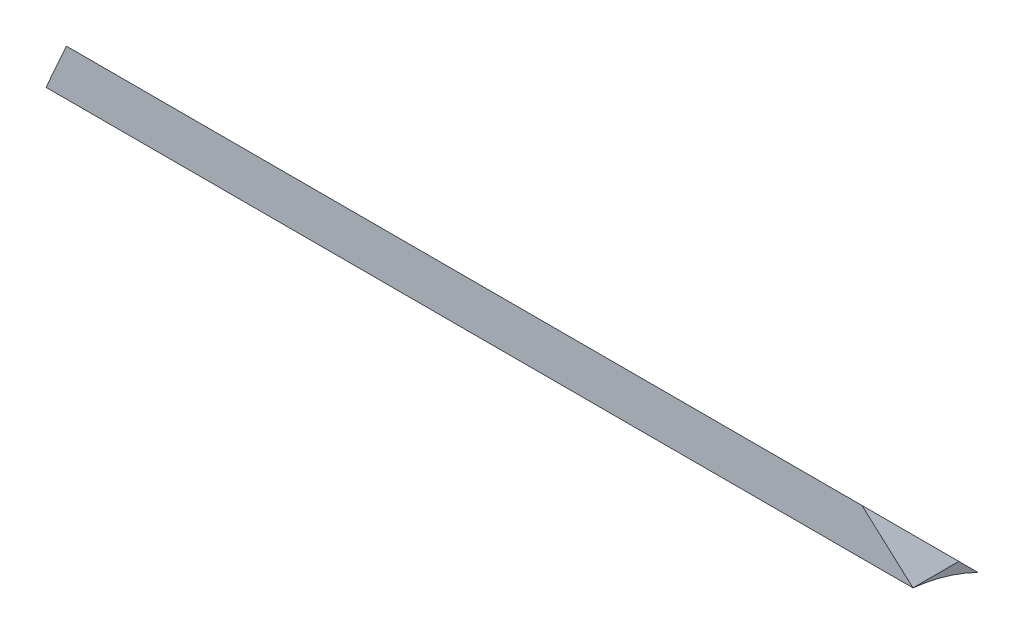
SolidWorks part; units mm, degrees
ref_plane "Front Plane" through (0, 0, 0) normal (0, 0, 1) x (1, 0, 0)
ref_plane "Top Plane" through (0, 0, 0) normal (0, 1, 0) x (1, 0, 0)
ref_plane "Right Plane" through (0, 0, 0) normal (1, 0, 0) x (0, 0, -1)
sketch "Sketch1" plane through (0, 0, 0) normal (0, 1, 0) x (1, 0, 0)
  line L1 (0, 0) -> (127, 0)
  line L2 (0, 0) -> (0, 12.7)
  line L3 (0, 12.7) -> (127, 12.7)
  line L4 (127, 0) -> (127, 12.7)
  dimension "D1" = 127
  dimension "D2" = 12.7
extrude "Extrude1" add sketch "Sketch1" along normal blind 12.7
sketch "Sketch2" plane through (127, 0, 0) normal (1, 0, 0) x (0, 0, -1)
  line L0 (0, 12.7) -> (12.7, 0)
  line L1 (0, 12.7) -> (12.7, 12.7)
  line L2 (12.7, 12.7) -> (12.7, 0)
extrude "Cut-Extrude1" cut sketch "Sketch2" against normal through all
sketch "Sketch3" plane through (127, 0, 0) normal (1, 0, 0) x (0, 0, -1)
  line L0 (0, 2.9773) -> (0, 19.3204)
  line L1 (0, 19.3204) -> (3.175, 19.3204)
  line L2 (3.175, 19.3204) -> (3.175, 2.8004)
  arc A0 (0, 2.9773) -> (3.175, 2.8004) centre (0, -25.5977) ccw
  dimension "D1" = 28.575
  dimension "D2" = 3.175
extrude "Cut-Extrude2" cut sketch "Sketch3" against normal through all
sketch "Sketch5" plane through (0, 0, 0) normal (0, 0, 1) x (1, 0, 0)
  line L0 (127, 0) -> (127, 2.8004)
  line L1 (127, 2.8004) -> (63.5, 59.9504)
  line L2 (63.5, 59.9504) -> (25.4, 59.9504)
  line L3 (25.4, 59.9504) -> (0, 2.8004)
  line L4 (0, 0) -> (127, 0)
  line L5 (0, 2.8004) -> (0, 0)
  line L6 (0, 2.8004) -> (127, 2.8004) construction
  dimension "D1" = 25.4
  dimension "D2" = 63.5
  dimension "D3" = 57.15
extrude "Cut-Extrude6" cut sketch "Sketch5" against normal through all flip side to cut
